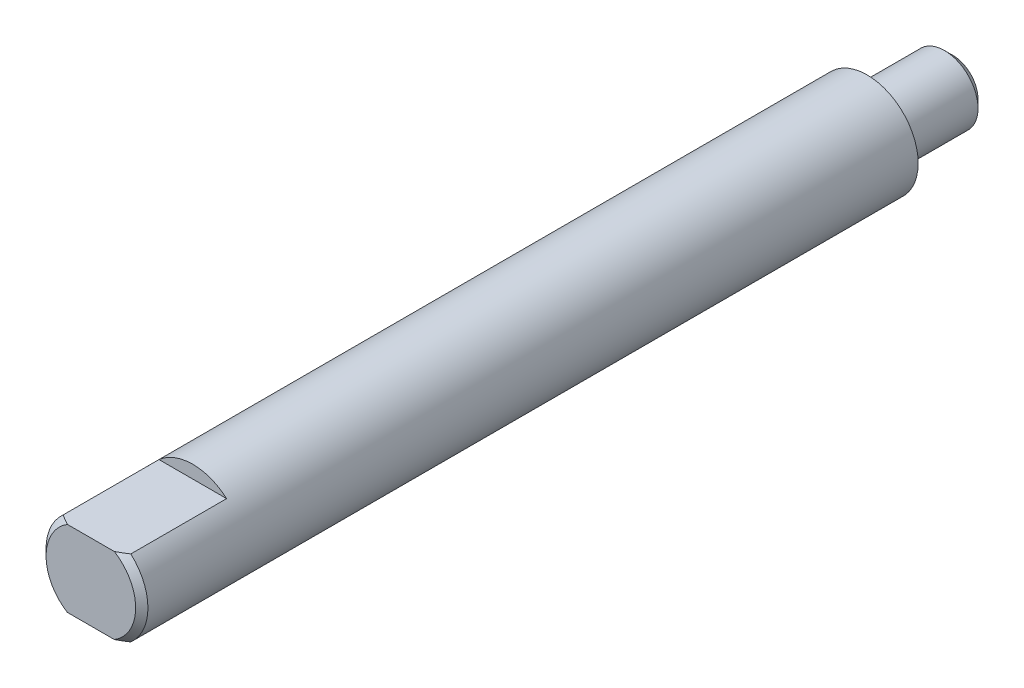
SolidWorks part; units mm, degrees
ref_plane "Front" through (0, 0, 0) normal (0, 0, 1) x (1, 0, 0)
ref_plane "Top" through (0, 0, 0) normal (0, 1, 0) x (1, 0, 0)
ref_plane "Right" through (0, 0, 0) normal (1, 0, 0) x (0, 0, -1)
sketch "Sketch1" plane through (0, 0, 0) normal (1, 0, 0) x (0, 0, -1)
  line L0 (49.6276, 1.5728) -> (49.1176, 2.0828)
  line L1 (-4.064, 0) -> (49.6276, 0)
  line L2 (-4.064, 0) -> (-4.064, 2.79)
  line L3 (-3.684, 3.175) -> (44.2976, 3.175)
  line L4 (44.2976, 2.0828) -> (44.2976, 3.175)
  line L5 (153.7168, 0) -> (50153.7168, 0) construction
  line L6 (-4.064, 2.79) -> (-3.684, 3.175)
  line L7 (44.2976, 2.0828) -> (49.1176, 2.0828)
  line L8 (49.6276, 0) -> (49.6276, 1.5728)
  point P2 (0, 0)
  point P12 (-7.1269, 7.0388)
  dimension "D1" = 48.3616
  dimension "D2" = 5.33
  dimension "D3" = 6.35
  dimension "D4" = 4.1656
  dimension "D5" = 45
  dimension "D6" = 0.51
  dimension "D7" = 2.79
  dimension "D8" = 0.38
  dimension "D9" = 4.064
revolve "Revolve1" add sketch "Sketch1" angle 360 about L1
sketch "Sketch2" plane through (0, 0, 0) normal (1, 0, 0) x (0, 0, -1)
  line L0 (-4.064, 2.79) -> (-4.064, -2.79) construction
  line L1 (-4.064, 2.375) -> (2.286, 2.375)
  line L2 (-4.064, 2.375) -> (-4.064, 3.175)
  line L3 (-4.064, 3.175) -> (2.286, 3.175)
  line L4 (2.286, 2.375) -> (2.286, 3.175)
  line L5 (44.2976, 3.175) -> (-3.684, 3.175) construction
  line L6 (-4.064, 0) -> (6.0404, 0) construction
  line L7 (2.286, -2.375) -> (2.286, -3.175)
  line L8 (-4.064, -3.175) -> (2.286, -3.175)
  line L9 (-4.064, -2.375) -> (-4.064, -3.175)
  line L10 (-4.064, -2.375) -> (2.286, -2.375)
  dimension "D1" = 0.8
  dimension "D2" = 6.35
extrude "Cut-Extrude1" cut sketch "Sketch2" against normal mid plane 10
